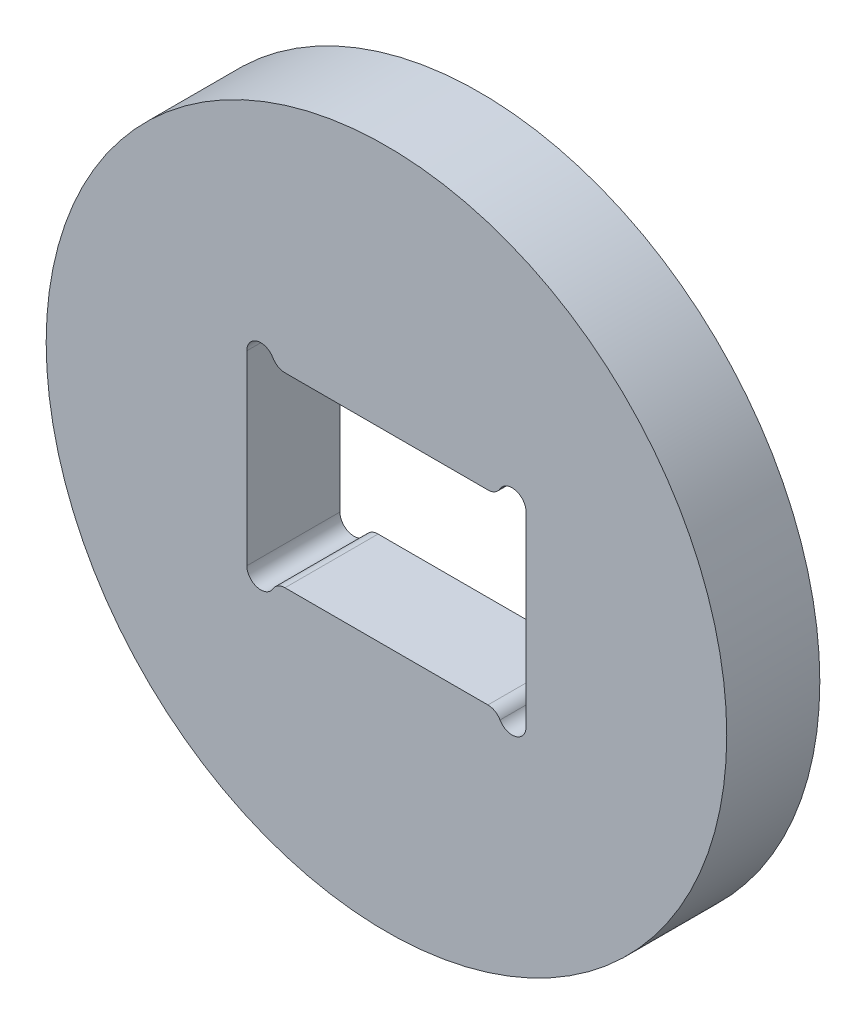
SolidWorks part; units mm, degrees
ref_plane "Plan de face" through (0, 0, 0) normal (0, 0, 1) x (1, 0, 0)
ref_plane "Plan de dessus" through (0, 0, 0) normal (0, 1, 0) x (1, 0, 0)
ref_plane "Plan de droite" through (0, 0, 0) normal (1, 0, 0) x (0, 0, -1)
sketch "Esquisse1" plane through (0, 0, 0) normal (0, 0, 1) x (1, 0, 0)
  line L0 (-47.0465, 30.0201) -> (-47.0465, 10.0201)
  line L1 (-51.1446, 10.0201) -> (-72.9484, 10.0201)
  line L2 (-77.0465, 10.0201) -> (-77.0465, 30.0201)
  line L3 (-72.9484, 30.0201) -> (-51.1446, 30.0201)
  arc A0 (-51.1446, 30.0201) -> (-49.8455, 30.7701) centre (-51.1446, 31.5201) ccw
  arc A1 (-47.0465, 30.0201) -> (-49.8455, 30.7701) centre (-48.5465, 30.0201) ccw
  arc A2 (-49.8455, 9.2701) -> (-47.0465, 10.0201) centre (-48.5465, 10.0201) ccw
  arc A3 (-49.8455, 9.2701) -> (-51.1446, 10.0201) centre (-51.1446, 8.5201) ccw
  arc A4 (-72.9484, 10.0201) -> (-74.2474, 9.2701) centre (-72.9484, 8.5201) ccw
  arc A5 (-77.0465, 10.0201) -> (-74.2474, 9.2701) centre (-75.5465, 10.0201) ccw
  arc A6 (-74.2474, 30.7701) -> (-77.0465, 30.0201) centre (-75.5465, 30.0201) ccw
  arc A7 (-74.2474, 30.7701) -> (-72.9484, 30.0201) centre (-72.9484, 31.5201) ccw
  circle A8 centre (-62.0465, 20.0201) radius 36.56
  dimension "D4" = 73.12
  dimension "D5" = 1.5
  dimension "D6" = 1.5
  dimension "D7" = 1.5
  dimension "D8" = 1.5
  dimension "D9" = 1.5
  dimension "D10" = 1.5
  dimension "D11" = 1.5
  dimension "D12" = 1.5
  dimension "D13" = 15
  dimension "D1" = 30
  dimension "D2" = 20
  dimension "D3" = 10
extrude "Boss.-Extru.1" add sketch "Esquisse1" along normal blind 10
